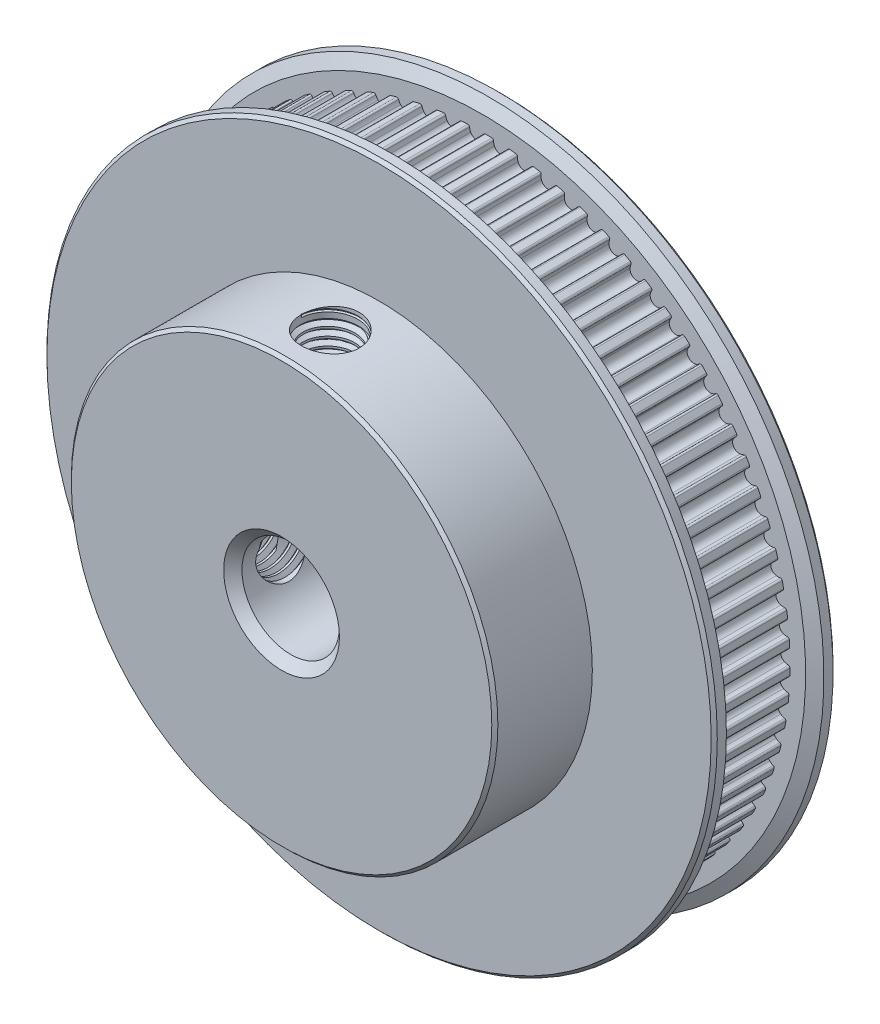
SolidWorks part; units mm, degrees
ref_plane "Front Plane" through (0, 0, 0) normal (0, 0, 1) x (1, 0, 0)
ref_plane "Top Plane" through (0, 0, 0) normal (0, 1, 0) x (1, 0, 0)
ref_plane "Right Plane" through (0, 0, 0) normal (1, 0, 0) x (0, 0, -1)
sketch "Sketch1" plane through (0, 0, 0) normal (0, 0, 1) x (1, 0, 0)
  point P0 (0, 0)
  circle B0 centre (0, 0) radius 4
  arc B1 (19.0272, -16.5574) -> (19.0206, -16.3595) centre (18.9113, -16.4622) ccw
  arc B2 (18.8243, -16.0882) -> (19.0206, -16.3595) centre (19.7211, -15.6459) ccw
  arc B3 (18.902, -15.5099) -> (18.8243, -16.0882) centre (19.331, -15.8619) ccw
  arc B4 (19.454, -15.3207) -> (18.902, -15.5099) centre (19.331, -15.8619) ccw
  arc B5 (19.7585, -15.4603) -> (19.454, -15.3207) centre (19.1953, -16.2867) ccw
  arc B6 (19.7585, -15.4603) -> (19.9538, -15.4282) centre (19.8378, -15.333) ccw
  arc B7 (19.9538, -15.4282) -> (20.2676, -15.0135) centre (0.0094, -0.0071) ccw
  arc B8 (20.2676, -15.0135) -> (20.2455, -14.8168) centre (20.1446, -14.9277) ccw
  arc B9 (20.0285, -14.5617) -> (20.2455, -14.8168) centre (20.8879, -14.0504) ccw
  arc B10 (20.0606, -13.979) -> (20.0285, -14.5617) centre (20.516, -14.2963) ccw
  arc B11 (20.5961, -13.7472) -> (20.0606, -13.979) centre (20.516, -14.2963) ccw
  arc B12 (20.9105, -13.8624) -> (20.5961, -13.7472) centre (20.414, -14.7304) ccw
  arc B13 (20.9105, -13.8624) -> (21.1027, -13.815) centre (20.9797, -13.7293) ccw
  arc B14 (21.1027, -13.815) -> (21.3831, -13.377) centre (0.01, -0.0064) ccw
  arc B15 (21.3831, -13.377) -> (21.3456, -13.1826) centre (21.2537, -13.3012) ccw
  arc B16 (21.1093, -12.9454) -> (21.3456, -13.1826) centre (21.9259, -12.3682) ccw
  arc B17 (21.0956, -12.362) -> (21.1093, -12.9454) centre (21.5744, -12.6426) ccw
  arc B18 (21.6112, -12.0888) -> (21.0956, -12.362) centre (21.5744, -12.6426) ccw
  arc B19 (21.9337, -12.1791) -> (21.6112, -12.0888) centre (21.5068, -13.0834) ccw
  arc B20 (21.9337, -12.1791) -> (22.1216, -12.1168) centre (21.9922, -12.0409) ccw
  arc B21 (22.1216, -12.1168) -> (22.3667, -11.6581) centre (0.0104, -0.0056) ccw
  arc B22 (22.3667, -11.6581) -> (22.3141, -11.4672) centre (22.2318, -11.5926) ccw
  arc B23 (22.0599, -11.2493) -> (22.3141, -11.4672) centre (22.8287, -10.6098) ccw
  arc B24 (22.0004, -10.6687) -> (22.0599, -11.2493) centre (22.4998, -10.9109) ccw
  arc B25 (22.4931, -10.356) -> (22.0004, -10.6687) centre (22.4998, -10.9109) ccw
  arc B26 (22.8217, -10.4206) -> (22.4931, -10.356) centre (22.467, -11.3556) ccw
  arc B27 (22.8217, -10.4206) -> (23.0041, -10.3438) centre (22.8691, -10.2783) ccw
  arc B28 (23.0041, -10.3438) -> (23.2125, -9.8673) centre (0.0108, -0.0047) ccw
  arc B29 (23.2125, -9.8673) -> (23.145, -9.6811) centre (23.0728, -9.8126) ccw
  arc B30 (22.8745, -9.4838) -> (23.145, -9.6811) centre (23.5908, -8.786) ccw
  arc B31 (22.7697, -8.9097) -> (22.8745, -9.4838) centre (23.2865, -9.112) ccw
  arc B32 (23.2363, -8.5592) -> (22.7697, -8.9097) centre (23.2865, -9.112) ccw
  arc B33 (23.5689, -8.5979) -> (23.2363, -8.5592) centre (23.2887, -9.5579) ccw
  arc B34 (23.5689, -8.5979) -> (23.7447, -8.507) centre (23.605, -8.4523) ccw
  arc B35 (23.7447, -8.507) -> (23.9151, -8.0156) centre (0.0112, -0.0039) ccw
  arc B36 (23.9151, -8.0156) -> (23.8333, -7.8354) centre (23.7715, -7.9721) ccw
  arc B37 (23.5481, -7.6599) -> (23.8333, -7.8354) centre (24.2074, -6.908) ccw
  arc B38 (23.3985, -7.0958) -> (23.5481, -7.6599) centre (23.9296, -7.2568) ccw
  arc B39 (23.8362, -6.7098) -> (23.3985, -7.0958) centre (23.9296, -7.2568) ccw
  arc B40 (24.1708, -6.7222) -> (23.8362, -6.7098) centre (23.9668, -7.7012) ccw
  arc B41 (24.1708, -6.7222) -> (24.339, -6.6178) centre (24.1954, -6.5743) ccw
  arc B42 (24.339, -6.6178) -> (24.4703, -6.1145) centre (0.0115, -0.003) ccw
  arc B43 (24.4703, -6.1145) -> (24.3746, -5.9413) centre (24.3237, -6.0824) ccw
  arc B44 (24.0765, -5.7887) -> (24.3746, -5.9413) centre (24.6747, -4.9874) ccw
  arc B45 (23.8831, -5.2381) -> (24.0765, -5.7887) centre (24.4252, -5.357) ccw
  arc B46 (24.2891, -4.8189) -> (23.8831, -5.2381) centre (24.4252, -5.357) ccw
  arc B47 (24.6237, -4.8051) -> (24.2891, -4.8189) centre (24.4972, -5.797) ccw
  arc B48 (24.6237, -4.8051) -> (24.7832, -4.6878) centre (24.6367, -4.6556) ccw
  arc B49 (24.7832, -4.6878) -> (24.8746, -4.1758) centre (0.0117, -0.0021) ccw
  arc B50 (24.8746, -4.1758) -> (24.7656, -4.0106) centre (24.726, -4.1552) ccw
  arc B51 (24.4564, -3.8818) -> (24.7656, -4.0106) centre (24.99, -3.0361) ccw
  arc B52 (24.2205, -3.3481) -> (24.4564, -3.8818) centre (24.7703, -3.4241) ccw
  arc B53 (24.5924, -2.8984) -> (24.2205, -3.3481) centre (24.7703, -3.4241) ccw
  arc B54 (24.9248, -2.8583) -> (24.5924, -2.8984) centre (24.8765, -3.8571) ccw
  arc B55 (24.9248, -2.8583) -> (25.0746, -2.7289) centre (24.926, -2.7083) ccw
  arc B56 (25.0746, -2.7289) -> (25.1255, -2.2113) centre (0.0118, -0.0012) ccw
  arc B57 (25.1255, -2.2113) -> (25.0039, -2.0551) centre (24.9758, -2.2025) ccw
  arc B58 (24.6856, -1.951) -> (25.0039, -2.0551) centre (25.1512, -1.066) ccw
  arc B59 (24.4085, -1.4374) -> (24.6856, -1.951) centre (24.9625, -1.4701) ccw
  arc B60 (24.744, -0.9599) -> (24.4085, -1.4374) centre (24.9625, -1.4701) ccw
  arc B61 (25.0723, -0.8939) -> (24.744, -0.9599) centre (25.1024, -1.8935) ccw
  arc B62 (25.0723, -0.8939) -> (25.2114, -0.7531) centre (25.0616, -0.7443) ccw
  arc B63 (25.2114, -0.7531) -> (25.2215, -0.2331) centre (0.0118, -0.0002) ccw
  arc B64 (25.2215, -0.2331) -> (25.088, -0.087) centre (25.0716, -0.2361) ccw
  arc B65 (24.7626, -0.0082) -> (25.088, -0.087) centre (25.1573, 0.9106) ccw
  arc B66 (24.446, 0.4821) -> (24.7626, -0.0082) centre (25.0009, 0.493) ccw
  arc B67 (24.743, 0.9844) -> (24.446, 0.4821) centre (25.0009, 0.493) ccw
  arc B68 (25.0651, 1.076) -> (24.743, 0.9844) centre (25.1736, 0.0819) ccw
  arc B69 (25.0651, 1.076) -> (25.1928, 1.2273) centre (25.0428, 1.2243) ccw
  arc B70 (25.1928, 1.2273) -> (25.1621, 1.7465) centre (0.0118, 0.0007) ccw
  arc B71 (25.1621, 1.7465) -> (25.0175, 1.8817) centre (25.0128, 1.7317) ccw
  arc B72 (24.6869, 1.9347) -> (25.0175, 1.8817) centre (25.0083, 2.8816) ccw
  arc B73 (24.3329, 2.3986) -> (24.6869, 1.9347) centre (24.8852, 2.453) ccw
  arc B74 (24.5895, 2.9227) -> (24.3329, 2.3986) centre (24.8852, 2.453) ccw
  arc B75 (24.9034, 3.0393) -> (24.5895, 2.9227) centre (25.0896, 2.0567) ccw
  arc B76 (24.9034, 3.0393) -> (25.0188, 3.2001) centre (24.8695, 3.1854) ccw
  arc B77 (25.0188, 3.2001) -> (24.9475, 3.7153) centre (0.0117, 0.0016) ccw
  arc B78 (24.9475, 3.7153) -> (24.7928, 3.8387) centre (24.7998, 3.6889) ccw
  arc B79 (24.459, 3.8656) -> (24.7928, 3.8387) centre (24.7051, 4.8349) ccw
  arc B80 (24.0697, 4.3003) -> (24.459, 3.8656) centre (24.616, 4.3979) ccw
  arc B81 (24.2844, 4.843) -> (24.0697, 4.3003) centre (24.616, 4.3979) ccw
  arc B82 (24.5882, 4.9838) -> (24.2844, 4.843) centre (24.8509, 4.0189) ccw
  arc B83 (24.5882, 4.9838) -> (24.6906, 5.1532) centre (24.5429, 5.1268) ccw
  arc B84 (24.6906, 5.1532) -> (24.5791, 5.6612) centre (0.0116, 0.0025) ccw
  arc B85 (24.5791, 5.6612) -> (24.4152, 5.7721) centre (24.434, 5.6233) ccw
  arc B86 (24.0803, 5.7727) -> (24.4152, 5.7721) centre (24.2496, 6.7583) ccw
  arc B87 (23.6581, 6.1756) -> (24.0803, 5.7727) centre (24.1951, 6.3157) ccw
  arc B88 (23.8295, 6.7334) -> (23.6581, 6.1756) centre (24.1951, 6.3157) ccw
  arc B89 (24.1214, 6.8976) -> (23.8295, 6.7334) centre (24.4589, 5.9563) ccw
  arc B90 (24.1214, 6.8976) -> (24.2102, 7.0745) centre (24.065, 7.0366) ccw
  arc B91 (24.2102, 7.0745) -> (24.0592, 7.5722) centre (0.0113, 0.0034) ccw
  arc B92 (24.0592, 7.5722) -> (23.887, 7.6699) centre (23.9174, 7.523) ccw
  arc B93 (23.5531, 7.6443) -> (23.887, 7.6699) centre (23.6446, 8.6401) ccw
  arc B94 (23.1006, 8.0127) -> (23.5531, 7.6443) centre (23.625, 8.1946) ccw
  arc B95 (23.2278, 8.5822) -> (23.1006, 8.0127) centre (23.625, 8.1946) ccw
  arc B96 (23.5058, 8.7689) -> (23.2278, 8.5822) centre (23.9162, 7.8569) ccw
  arc B97 (23.5058, 8.7689) -> (23.5805, 8.9522) centre (23.4388, 8.903) ccw
  arc B98 (23.5805, 8.9522) -> (23.3909, 9.4365) centre (0.011, 0.0043) ccw
  arc B99 (23.3909, 9.4365) -> (23.2116, 9.5204) centre (23.2535, 9.3764) ccw
  arc B100 (22.8808, 9.4686) -> (23.2116, 9.5204) centre (22.8938, 10.4686) ccw
  arc B101 (22.4007, 9.8005) -> (22.8808, 9.4686) centre (22.9092, 10.0229) ccw
  arc B102 (22.4828, 10.3782) -> (22.4007, 9.8005) centre (22.9092, 10.0229) ccw
  arc B103 (22.7454, 10.5861) -> (22.4828, 10.3782) centre (23.226, 9.7092) ccw
  arc B104 (22.7454, 10.5861) -> (22.8054, 10.7747) centre (22.668, 10.7146) ccw
  arc B105 (22.8054, 10.7747) -> (22.5784, 11.2426) centre (0.0106, 0.0052) ccw
  arc B106 (22.5784, 11.2426) -> (22.3931, 11.3122) centre (22.4461, 11.1719) ccw
  arc B107 (22.0673, 11.2347) -> (22.3931, 11.3122) centre (22.0019, 12.2325) ccw
  arc B108 (21.5627, 11.5278) -> (22.0673, 11.2347) centre (22.0522, 11.7895) ccw
  arc B109 (21.5992, 12.1102) -> (21.5627, 11.5278) centre (22.0522, 11.7895) ccw
  arc B110 (21.8447, 12.338) -> (21.5992, 12.1102) centre (22.3927, 11.5015) ccw
  arc B111 (21.8447, 12.338) -> (21.8897, 12.5308) centre (21.7575, 12.4601) ccw
  arc B112 (21.8897, 12.5308) -> (21.6267, 12.9794) centre (0.0102, 0.006) ccw
  arc B113 (21.6267, 12.9794) -> (21.4365, 13.0343) centre (21.5004, 12.8986) ccw
  arc B114 (21.1178, 12.9314) -> (21.4365, 13.0343) centre (20.9743, 13.9211) ccw
  arc B115 (20.5918, 13.184) -> (21.1178, 12.9314) centre (21.0592, 13.4833) ccw
  arc B116 (20.5825, 13.7675) -> (20.5918, 13.184) centre (21.0592, 13.4833) ccw
  arc B117 (20.8093, 14.0139) -> (20.5825, 13.7675) centre (21.4212, 13.223) ccw
  arc B118 (20.8093, 14.0139) -> (20.8391, 14.2096) centre (20.7128, 14.1287) ccw
  arc B119 (20.8391, 14.2096) -> (20.5417, 14.6362) centre (0.0097, 0.0068) ccw
  arc B120 (20.5417, 14.6362) -> (20.3478, 14.676) centre (20.4221, 14.5457) ccw
  arc B121 (20.0382, 14.5484) -> (20.3478, 14.676) centre (19.8174, 15.5238) ccw
  arc B122 (19.4939, 14.759) -> (20.0382, 14.5484) centre (19.9364, 15.094) ccw
  arc B123 (19.4389, 15.34) -> (19.4939, 14.759) centre (19.9364, 15.094) ccw
  arc B124 (19.6457, 15.6034) -> (19.4389, 15.34) centre (20.3177, 14.8629) ccw
  arc B125 (19.6457, 15.6034) -> (19.66, 15.8008) centre (19.5404, 15.7103) ccw
  arc B126 (19.66, 15.8008) -> (19.33, 16.2028) centre (0.0091, 0.0075) ccw
  arc B127 (19.33, 16.2028) -> (19.1336, 16.2272) centre (19.2179, 16.1032) ccw
  arc B128 (18.8349, 16.0758) -> (19.1336, 16.2272) centre (18.5383, 17.0308) ccw
  arc B129 (18.2758, 16.243) -> (18.8349, 16.0758) centre (18.6907, 16.6117) ccw
  arc B130 (18.1754, 16.8178) -> (18.2758, 16.243) centre (18.6907, 16.6117) ccw
  arc B131 (18.3609, 17.0967) -> (18.1754, 16.8178) centre (19.089, 16.4112) ccw
  arc B132 (18.3609, 17.0967) -> (18.3597, 17.2946) centre (18.2476, 17.195) ccw
  arc B133 (18.3597, 17.2946) -> (17.9992, 17.6695) centre (0.0085, 0.0082) ccw
  arc B134 (17.9992, 17.6695) -> (17.8014, 17.6784) centre (17.8952, 17.5613) ccw
  arc B135 (17.5156, 17.504) -> (17.8014, 17.6784) centre (17.145, 18.4328) ccw
  arc B136 (16.9451, 17.6268) -> (17.5156, 17.504) centre (17.3297, 18.0269) ccw
  arc B137 (16.7998, 18.192) -> (16.9451, 17.6268) centre (17.3297, 18.0269) ccw
  arc B138 (16.9629, 18.4845) -> (16.7998, 18.192) centre (17.7425, 17.8583) ccw
  arc B139 (16.9629, 18.4845) -> (16.9462, 18.6818) centre (16.8422, 18.5736) ccw
  arc B140 (16.9462, 18.6818) -> (16.5574, 19.0272) centre (0.0079, 0.0088) ccw
  arc B141 (16.5574, 19.0272) -> (16.3595, 19.0206) centre (16.4622, 18.9113) ccw
  arc B142 (16.0882, 18.8243) -> (16.3595, 19.0206) centre (15.6459, 19.7211) ccw
  arc B143 (15.5099, 18.902) -> (16.0882, 18.8243) centre (15.8619, 19.331) ccw
  arc B144 (15.3207, 19.454) -> (15.5099, 18.902) centre (15.8619, 19.331) ccw
  arc B145 (15.4603, 19.7585) -> (15.3207, 19.454) centre (16.2867, 19.1953) ccw
  arc B146 (15.4603, 19.7585) -> (15.4282, 19.9538) centre (15.333, 19.8378) ccw
  arc B147 (15.4282, 19.9538) -> (15.0135, 20.2676) centre (0.0071, 0.0094) ccw
  arc B148 (15.0135, 20.2676) -> (14.8168, 20.2455) centre (14.9277, 20.1446) ccw
  arc B149 (14.5617, 20.0285) -> (14.8168, 20.2455) centre (14.0504, 20.8879) ccw
  arc B150 (13.979, 20.0606) -> (14.5617, 20.0285) centre (14.2963, 20.516) ccw
  arc B151 (13.7472, 20.5961) -> (13.979, 20.0606) centre (14.2963, 20.516) ccw
  arc B152 (13.8624, 20.9105) -> (13.7472, 20.5961) centre (14.7304, 20.414) ccw
  arc B153 (13.8624, 20.9105) -> (13.815, 21.1027) centre (13.7293, 20.9797) ccw
  arc B154 (13.815, 21.1027) -> (13.377, 21.3831) centre (0.0064, 0.01) ccw
  arc B155 (13.377, 21.3831) -> (13.1826, 21.3456) centre (13.3012, 21.2537) ccw
  arc B156 (12.9454, 21.1093) -> (13.1826, 21.3456) centre (12.3682, 21.9259) ccw
  arc B157 (12.362, 21.0956) -> (12.9454, 21.1093) centre (12.6426, 21.5744) ccw
  arc B158 (12.0888, 21.6112) -> (12.362, 21.0956) centre (12.6426, 21.5744) ccw
  arc B159 (12.1791, 21.9337) -> (12.0888, 21.6112) centre (13.0834, 21.5068) ccw
  arc B160 (12.1791, 21.9337) -> (12.1168, 22.1216) centre (12.0409, 21.9922) ccw
  arc B161 (12.1168, 22.1216) -> (11.6581, 22.3667) centre (0.0056, 0.0104) ccw
  arc B162 (11.6581, 22.3667) -> (11.4672, 22.3141) centre (11.5926, 22.2318) ccw
  arc B163 (11.2493, 22.0599) -> (11.4672, 22.3141) centre (10.6098, 22.8287) ccw
  arc B164 (10.6687, 22.0004) -> (11.2493, 22.0599) centre (10.9109, 22.4998) ccw
  arc B165 (10.356, 22.4931) -> (10.6687, 22.0004) centre (10.9109, 22.4998) ccw
  arc B166 (10.4206, 22.8217) -> (10.356, 22.4931) centre (11.3556, 22.467) ccw
  arc B167 (10.4206, 22.8217) -> (10.3438, 23.0041) centre (10.2783, 22.8691) ccw
  arc B168 (10.3438, 23.0041) -> (9.8673, 23.2125) centre (0.0047, 0.0108) ccw
  arc B169 (9.8673, 23.2125) -> (9.6811, 23.145) centre (9.8126, 23.0728) ccw
  arc B170 (9.4838, 22.8745) -> (9.6811, 23.145) centre (8.786, 23.5908) ccw
  arc B171 (8.9097, 22.7697) -> (9.4838, 22.8745) centre (9.112, 23.2865) ccw
  arc B172 (8.5592, 23.2363) -> (8.9097, 22.7697) centre (9.112, 23.2865) ccw
  arc B173 (8.5979, 23.5689) -> (8.5592, 23.2363) centre (9.5579, 23.2887) ccw
  arc B174 (8.5979, 23.5689) -> (8.507, 23.7447) centre (8.4523, 23.605) ccw
  arc B175 (8.507, 23.7447) -> (8.0156, 23.9151) centre (0.0039, 0.0112) ccw
  arc B176 (8.0156, 23.9151) -> (7.8354, 23.8333) centre (7.9721, 23.7715) ccw
  arc B177 (7.6599, 23.5481) -> (7.8354, 23.8333) centre (6.908, 24.2074) ccw
  arc B178 (7.0958, 23.3985) -> (7.6599, 23.5481) centre (7.2568, 23.9296) ccw
  arc B179 (6.7098, 23.8362) -> (7.0958, 23.3985) centre (7.2568, 23.9296) ccw
  arc B180 (6.7222, 24.1708) -> (6.7098, 23.8362) centre (7.7012, 23.9668) ccw
  arc B181 (6.7222, 24.1708) -> (6.6178, 24.339) centre (6.5743, 24.1954) ccw
  arc B182 (6.6178, 24.339) -> (6.1145, 24.4703) centre (0.003, 0.0115) ccw
  arc B183 (6.1145, 24.4703) -> (5.9413, 24.3746) centre (6.0824, 24.3237) ccw
  arc B184 (5.7887, 24.0765) -> (5.9413, 24.3746) centre (4.9874, 24.6747) ccw
  arc B185 (5.2381, 23.8831) -> (5.7887, 24.0765) centre (5.357, 24.4252) ccw
  arc B186 (4.8189, 24.2891) -> (5.2381, 23.8831) centre (5.357, 24.4252) ccw
  arc B187 (4.8051, 24.6237) -> (4.8189, 24.2891) centre (5.797, 24.4972) ccw
  arc B188 (4.8051, 24.6237) -> (4.6878, 24.7832) centre (4.6556, 24.6367) ccw
  arc B189 (4.6878, 24.7832) -> (4.1758, 24.8746) centre (0.0021, 0.0117) ccw
  arc B190 (4.1758, 24.8746) -> (4.0106, 24.7656) centre (4.1552, 24.726) ccw
  arc B191 (3.8818, 24.4564) -> (4.0106, 24.7656) centre (3.0361, 24.99) ccw
  arc B192 (3.3481, 24.2205) -> (3.8818, 24.4564) centre (3.4241, 24.7703) ccw
  arc B193 (2.8984, 24.5924) -> (3.3481, 24.2205) centre (3.4241, 24.7703) ccw
  arc B194 (2.8583, 24.9248) -> (2.8984, 24.5924) centre (3.8571, 24.8765) ccw
  arc B195 (2.8583, 24.9248) -> (2.7289, 25.0746) centre (2.7083, 24.926) ccw
  arc B196 (2.7289, 25.0746) -> (2.2113, 25.1255) centre (0.0012, 0.0118) ccw
  arc B197 (2.2113, 25.1255) -> (2.0551, 25.0039) centre (2.2025, 24.9758) ccw
  arc B198 (1.951, 24.6856) -> (2.0551, 25.0039) centre (1.066, 25.1512) ccw
  arc B199 (1.4374, 24.4085) -> (1.951, 24.6856) centre (1.4701, 24.9625) ccw
  arc B200 (0.9599, 24.744) -> (1.4374, 24.4085) centre (1.4701, 24.9625) ccw
  arc B201 (0.8939, 25.0723) -> (0.9599, 24.744) centre (1.8935, 25.1024) ccw
  arc B202 (0.8939, 25.0723) -> (0.7531, 25.2114) centre (0.7443, 25.0616) ccw
  arc B203 (0.7531, 25.2114) -> (0.2331, 25.2215) centre (0.0002, 0.0118) ccw
  arc B204 (0.2331, 25.2215) -> (0.087, 25.088) centre (0.2361, 25.0716) ccw
  arc B205 (0.0082, 24.7626) -> (0.087, 25.088) centre (-0.9106, 25.1573) ccw
  arc B206 (-0.4821, 24.446) -> (0.0082, 24.7626) centre (-0.493, 25.0009) ccw
  arc B207 (-0.9844, 24.743) -> (-0.4821, 24.446) centre (-0.493, 25.0009) ccw
  arc B208 (-1.076, 25.0651) -> (-0.9844, 24.743) centre (-0.0819, 25.1736) ccw
  arc B209 (-1.076, 25.0651) -> (-1.2273, 25.1928) centre (-1.2243, 25.0428) ccw
  arc B210 (-1.2273, 25.1928) -> (-1.7465, 25.1621) centre (-0.0007, 0.0118) ccw
  arc B211 (-1.7465, 25.1621) -> (-1.8817, 25.0175) centre (-1.7317, 25.0128) ccw
  arc B212 (-1.9347, 24.6869) -> (-1.8817, 25.0175) centre (-2.8816, 25.0083) ccw
  arc B213 (-2.3986, 24.3329) -> (-1.9347, 24.6869) centre (-2.453, 24.8852) ccw
  arc B214 (-2.9227, 24.5895) -> (-2.3986, 24.3329) centre (-2.453, 24.8852) ccw
  arc B215 (-3.0393, 24.9034) -> (-2.9227, 24.5895) centre (-2.0567, 25.0896) ccw
  arc B216 (-3.0393, 24.9034) -> (-3.2001, 25.0188) centre (-3.1854, 24.8695) ccw
  arc B217 (-3.2001, 25.0188) -> (-3.7153, 24.9475) centre (-0.0016, 0.0117) ccw
  arc B218 (-3.7153, 24.9475) -> (-3.8387, 24.7928) centre (-3.6889, 24.7998) ccw
  arc B219 (-3.8656, 24.459) -> (-3.8387, 24.7928) centre (-4.8349, 24.7051) ccw
  arc B220 (-4.3003, 24.0697) -> (-3.8656, 24.459) centre (-4.3979, 24.616) ccw
  arc B221 (-4.843, 24.2844) -> (-4.3003, 24.0697) centre (-4.3979, 24.616) ccw
  arc B222 (-4.9838, 24.5882) -> (-4.843, 24.2844) centre (-4.0189, 24.8509) ccw
  arc B223 (-4.9838, 24.5882) -> (-5.1532, 24.6906) centre (-5.1268, 24.5429) ccw
  arc B224 (-5.1532, 24.6906) -> (-5.6612, 24.5791) centre (-0.0025, 0.0116) ccw
  arc B225 (-5.6612, 24.5791) -> (-5.7721, 24.4152) centre (-5.6233, 24.434) ccw
  arc B226 (-5.7727, 24.0803) -> (-5.7721, 24.4152) centre (-6.7583, 24.2496) ccw
  arc B227 (-6.1756, 23.6581) -> (-5.7727, 24.0803) centre (-6.3157, 24.1951) ccw
  arc B228 (-6.7334, 23.8295) -> (-6.1756, 23.6581) centre (-6.3157, 24.1951) ccw
  arc B229 (-6.8976, 24.1214) -> (-6.7334, 23.8295) centre (-5.9563, 24.4589) ccw
  arc B230 (-6.8976, 24.1214) -> (-7.0745, 24.2102) centre (-7.0366, 24.065) ccw
  arc B231 (-7.0745, 24.2102) -> (-7.5722, 24.0592) centre (-0.0034, 0.0113) ccw
  arc B232 (-7.5722, 24.0592) -> (-7.6699, 23.887) centre (-7.523, 23.9174) ccw
  arc B233 (-7.6443, 23.5531) -> (-7.6699, 23.887) centre (-8.6401, 23.6446) ccw
  arc B234 (-8.0127, 23.1006) -> (-7.6443, 23.5531) centre (-8.1946, 23.625) ccw
  arc B235 (-8.5822, 23.2278) -> (-8.0127, 23.1006) centre (-8.1946, 23.625) ccw
  arc B236 (-8.7689, 23.5058) -> (-8.5822, 23.2278) centre (-7.8569, 23.9162) ccw
  arc B237 (-8.7689, 23.5058) -> (-8.9522, 23.5805) centre (-8.903, 23.4388) ccw
  arc B238 (-8.9522, 23.5805) -> (-9.4365, 23.3909) centre (-0.0043, 0.011) ccw
  arc B239 (-9.4365, 23.3909) -> (-9.5204, 23.2116) centre (-9.3764, 23.2535) ccw
  arc B240 (-9.4686, 22.8808) -> (-9.5204, 23.2116) centre (-10.4686, 22.8938) ccw
  arc B241 (-9.8005, 22.4007) -> (-9.4686, 22.8808) centre (-10.0229, 22.9092) ccw
  arc B242 (-10.3782, 22.4828) -> (-9.8005, 22.4007) centre (-10.0229, 22.9092) ccw
  arc B243 (-10.5861, 22.7454) -> (-10.3782, 22.4828) centre (-9.7092, 23.226) ccw
  arc B244 (-10.5861, 22.7454) -> (-10.7747, 22.8054) centre (-10.7146, 22.668) ccw
  arc B245 (-10.7747, 22.8054) -> (-11.2426, 22.5784) centre (-0.0052, 0.0106) ccw
  arc B246 (-11.2426, 22.5784) -> (-11.3122, 22.3931) centre (-11.1719, 22.4461) ccw
  arc B247 (-11.2347, 22.0673) -> (-11.3122, 22.3931) centre (-12.2325, 22.0019) ccw
  arc B248 (-11.5278, 21.5627) -> (-11.2347, 22.0673) centre (-11.7895, 22.0522) ccw
  arc B249 (-12.1102, 21.5992) -> (-11.5278, 21.5627) centre (-11.7895, 22.0522) ccw
  arc B250 (-12.338, 21.8447) -> (-12.1102, 21.5992) centre (-11.5015, 22.3927) ccw
  arc B251 (-12.338, 21.8447) -> (-12.5308, 21.8897) centre (-12.4601, 21.7575) ccw
  arc B252 (-12.5308, 21.8897) -> (-12.9794, 21.6267) centre (-0.006, 0.0102) ccw
  arc B253 (-12.9794, 21.6267) -> (-13.0343, 21.4365) centre (-12.8986, 21.5004) ccw
  arc B254 (-12.9314, 21.1178) -> (-13.0343, 21.4365) centre (-13.9211, 20.9743) ccw
  arc B255 (-13.184, 20.5918) -> (-12.9314, 21.1178) centre (-13.4833, 21.0592) ccw
  arc B256 (-13.7675, 20.5825) -> (-13.184, 20.5918) centre (-13.4833, 21.0592) ccw
  arc B257 (-14.0139, 20.8093) -> (-13.7675, 20.5825) centre (-13.223, 21.4212) ccw
  arc B258 (-14.0139, 20.8093) -> (-14.2096, 20.8391) centre (-14.1287, 20.7128) ccw
  arc B259 (-14.2096, 20.8391) -> (-14.6362, 20.5417) centre (-0.0068, 0.0097) ccw
  arc B260 (-14.6362, 20.5417) -> (-14.676, 20.3478) centre (-14.5457, 20.4221) ccw
  arc B261 (-14.5484, 20.0382) -> (-14.676, 20.3478) centre (-15.5238, 19.8174) ccw
  arc B262 (-14.759, 19.4939) -> (-14.5484, 20.0382) centre (-15.094, 19.9364) ccw
  arc B263 (-15.34, 19.4389) -> (-14.759, 19.4939) centre (-15.094, 19.9364) ccw
  arc B264 (-15.6034, 19.6457) -> (-15.34, 19.4389) centre (-14.8629, 20.3177) ccw
  arc B265 (-15.6034, 19.6457) -> (-15.8008, 19.66) centre (-15.7103, 19.5404) ccw
  arc B266 (-15.8008, 19.66) -> (-16.2028, 19.33) centre (-0.0075, 0.0091) ccw
  arc B267 (-16.2028, 19.33) -> (-16.2272, 19.1336) centre (-16.1032, 19.2179) ccw
  arc B268 (-16.0758, 18.8349) -> (-16.2272, 19.1336) centre (-17.0308, 18.5383) ccw
  arc B269 (-16.243, 18.2758) -> (-16.0758, 18.8349) centre (-16.6117, 18.6907) ccw
  arc B270 (-16.8178, 18.1754) -> (-16.243, 18.2758) centre (-16.6117, 18.6907) ccw
  arc B271 (-17.0967, 18.3609) -> (-16.8178, 18.1754) centre (-16.4112, 19.089) ccw
  arc B272 (-17.0967, 18.3609) -> (-17.2946, 18.3597) centre (-17.195, 18.2476) ccw
  arc B273 (-17.2946, 18.3597) -> (-17.6695, 17.9992) centre (-0.0082, 0.0085) ccw
  arc B274 (-17.6695, 17.9992) -> (-17.6784, 17.8014) centre (-17.5613, 17.8952) ccw
  arc B275 (-17.504, 17.5156) -> (-17.6784, 17.8014) centre (-18.4328, 17.145) ccw
  arc B276 (-17.6268, 16.9451) -> (-17.504, 17.5156) centre (-18.0269, 17.3297) ccw
  arc B277 (-18.192, 16.7998) -> (-17.6268, 16.9451) centre (-18.0269, 17.3297) ccw
  arc B278 (-18.4845, 16.9629) -> (-18.192, 16.7998) centre (-17.8583, 17.7425) ccw
  arc B279 (-18.4845, 16.9629) -> (-18.6818, 16.9462) centre (-18.5736, 16.8422) ccw
  arc B280 (-18.6818, 16.9462) -> (-19.0272, 16.5574) centre (-0.0088, 0.0079) ccw
  arc B281 (-19.0272, 16.5574) -> (-19.0206, 16.3595) centre (-18.9113, 16.4622) ccw
  arc B282 (-18.8243, 16.0882) -> (-19.0206, 16.3595) centre (-19.7211, 15.6459) ccw
  arc B283 (-18.902, 15.5099) -> (-18.8243, 16.0882) centre (-19.331, 15.8619) ccw
  arc B284 (-19.454, 15.3207) -> (-18.902, 15.5099) centre (-19.331, 15.8619) ccw
  arc B285 (-19.7585, 15.4603) -> (-19.454, 15.3207) centre (-19.1953, 16.2867) ccw
  arc B286 (-19.7585, 15.4603) -> (-19.9538, 15.4282) centre (-19.8378, 15.333) ccw
  arc B287 (-19.9538, 15.4282) -> (-20.2676, 15.0135) centre (-0.0094, 0.0071) ccw
  arc B288 (-20.2676, 15.0135) -> (-20.2455, 14.8168) centre (-20.1446, 14.9277) ccw
  arc B289 (-20.0285, 14.5617) -> (-20.2455, 14.8168) centre (-20.8879, 14.0504) ccw
  arc B290 (-20.0606, 13.979) -> (-20.0285, 14.5617) centre (-20.516, 14.2963) ccw
  arc B291 (-20.5961, 13.7472) -> (-20.0606, 13.979) centre (-20.516, 14.2963) ccw
  arc B292 (-20.9105, 13.8624) -> (-20.5961, 13.7472) centre (-20.414, 14.7304) ccw
  arc B293 (-20.9105, 13.8624) -> (-21.1027, 13.815) centre (-20.9797, 13.7293) ccw
  arc B294 (-21.1027, 13.815) -> (-21.3831, 13.377) centre (-0.01, 0.0064) ccw
  arc B295 (-21.3831, 13.377) -> (-21.3456, 13.1826) centre (-21.2537, 13.3012) ccw
  arc B296 (-21.1093, 12.9454) -> (-21.3456, 13.1826) centre (-21.9259, 12.3682) ccw
  arc B297 (-21.0956, 12.362) -> (-21.1093, 12.9454) centre (-21.5744, 12.6426) ccw
  arc B298 (-21.6112, 12.0888) -> (-21.0956, 12.362) centre (-21.5744, 12.6426) ccw
  arc B299 (-21.9337, 12.1791) -> (-21.6112, 12.0888) centre (-21.5068, 13.0834) ccw
  arc B300 (-21.9337, 12.1791) -> (-22.1216, 12.1168) centre (-21.9922, 12.0409) ccw
  arc B301 (-22.1216, 12.1168) -> (-22.3667, 11.6581) centre (-0.0104, 0.0056) ccw
  arc B302 (-22.3667, 11.6581) -> (-22.3141, 11.4672) centre (-22.2318, 11.5926) ccw
  arc B303 (-22.0599, 11.2493) -> (-22.3141, 11.4672) centre (-22.8287, 10.6098) ccw
  arc B304 (-22.0004, 10.6687) -> (-22.0599, 11.2493) centre (-22.4998, 10.9109) ccw
  arc B305 (-22.4931, 10.356) -> (-22.0004, 10.6687) centre (-22.4998, 10.9109) ccw
  arc B306 (-22.8217, 10.4206) -> (-22.4931, 10.356) centre (-22.467, 11.3556) ccw
  arc B307 (-22.8217, 10.4206) -> (-23.0041, 10.3438) centre (-22.8691, 10.2783) ccw
  arc B308 (-23.0041, 10.3438) -> (-23.2125, 9.8673) centre (-0.0108, 0.0047) ccw
  arc B309 (-23.2125, 9.8673) -> (-23.145, 9.6811) centre (-23.0728, 9.8126) ccw
  arc B310 (-22.8745, 9.4838) -> (-23.145, 9.6811) centre (-23.5908, 8.786) ccw
  arc B311 (-22.7697, 8.9097) -> (-22.8745, 9.4838) centre (-23.2865, 9.112) ccw
  arc B312 (-23.2363, 8.5592) -> (-22.7697, 8.9097) centre (-23.2865, 9.112) ccw
  arc B313 (-23.5689, 8.5979) -> (-23.2363, 8.5592) centre (-23.2887, 9.5579) ccw
  arc B314 (-23.5689, 8.5979) -> (-23.7447, 8.507) centre (-23.605, 8.4523) ccw
  arc B315 (-23.7447, 8.507) -> (-23.9151, 8.0156) centre (-0.0112, 0.0039) ccw
  arc B316 (-23.9151, 8.0156) -> (-23.8333, 7.8354) centre (-23.7715, 7.9721) ccw
  arc B317 (-23.5481, 7.6599) -> (-23.8333, 7.8354) centre (-24.2074, 6.908) ccw
  arc B318 (-23.3985, 7.0958) -> (-23.5481, 7.6599) centre (-23.9296, 7.2568) ccw
  arc B319 (-23.8362, 6.7098) -> (-23.3985, 7.0958) centre (-23.9296, 7.2568) ccw
  arc B320 (-24.1708, 6.7222) -> (-23.8362, 6.7098) centre (-23.9668, 7.7012) ccw
  arc B321 (-24.1708, 6.7222) -> (-24.339, 6.6178) centre (-24.1954, 6.5743) ccw
  arc B322 (-24.339, 6.6178) -> (-24.4703, 6.1145) centre (-0.0115, 0.003) ccw
  arc B323 (-24.4703, 6.1145) -> (-24.3746, 5.9413) centre (-24.3237, 6.0824) ccw
  arc B324 (-24.0765, 5.7887) -> (-24.3746, 5.9413) centre (-24.6747, 4.9874) ccw
  arc B325 (-23.8831, 5.2381) -> (-24.0765, 5.7887) centre (-24.4252, 5.357) ccw
  arc B326 (-24.2891, 4.8189) -> (-23.8831, 5.2381) centre (-24.4252, 5.357) ccw
  arc B327 (-24.6237, 4.8051) -> (-24.2891, 4.8189) centre (-24.4972, 5.797) ccw
  arc B328 (-24.6237, 4.8051) -> (-24.7832, 4.6878) centre (-24.6367, 4.6556) ccw
  arc B329 (-24.7832, 4.6878) -> (-24.8746, 4.1758) centre (-0.0117, 0.0021) ccw
  arc B330 (-24.8746, 4.1758) -> (-24.7656, 4.0106) centre (-24.726, 4.1552) ccw
  arc B331 (-24.4564, 3.8818) -> (-24.7656, 4.0106) centre (-24.99, 3.0361) ccw
  arc B332 (-24.2205, 3.3481) -> (-24.4564, 3.8818) centre (-24.7703, 3.4241) ccw
  arc B333 (-24.5924, 2.8984) -> (-24.2205, 3.3481) centre (-24.7703, 3.4241) ccw
  arc B334 (-24.9248, 2.8583) -> (-24.5924, 2.8984) centre (-24.8765, 3.8571) ccw
  arc B335 (-24.9248, 2.8583) -> (-25.0746, 2.7289) centre (-24.926, 2.7083) ccw
  arc B336 (-25.0746, 2.7289) -> (-25.1255, 2.2113) centre (-0.0118, 0.0012) ccw
  arc B337 (-25.1255, 2.2113) -> (-25.0039, 2.0551) centre (-24.9758, 2.2025) ccw
  arc B338 (-24.6856, 1.951) -> (-25.0039, 2.0551) centre (-25.1512, 1.066) ccw
  arc B339 (-24.4085, 1.4374) -> (-24.6856, 1.951) centre (-24.9625, 1.4701) ccw
  arc B340 (-24.744, 0.9599) -> (-24.4085, 1.4374) centre (-24.9625, 1.4701) ccw
  arc B341 (-25.0723, 0.8939) -> (-24.744, 0.9599) centre (-25.1024, 1.8935) ccw
  arc B342 (-25.0723, 0.8939) -> (-25.2114, 0.7531) centre (-25.0616, 0.7443) ccw
  arc B343 (-25.2114, 0.7531) -> (-25.2215, 0.2331) centre (-0.0118, 0.0002) ccw
  arc B344 (-25.2215, 0.2331) -> (-25.088, 0.087) centre (-25.0716, 0.2361) ccw
  arc B345 (-24.7626, 0.0082) -> (-25.088, 0.087) centre (-25.1573, -0.9106) ccw
  arc B346 (-24.446, -0.4821) -> (-24.7626, 0.0082) centre (-25.0009, -0.493) ccw
  arc B347 (-24.743, -0.9844) -> (-24.446, -0.4821) centre (-25.0009, -0.493) ccw
  arc B348 (-25.0651, -1.076) -> (-24.743, -0.9844) centre (-25.1736, -0.0819) ccw
  arc B349 (-25.0651, -1.076) -> (-25.1928, -1.2273) centre (-25.0428, -1.2243) ccw
  arc B350 (-25.1928, -1.2273) -> (-25.1621, -1.7465) centre (-0.0118, -0.0007) ccw
  arc B351 (-25.1621, -1.7465) -> (-25.0175, -1.8817) centre (-25.0128, -1.7317) ccw
  arc B352 (-24.6869, -1.9347) -> (-25.0175, -1.8817) centre (-25.0083, -2.8816) ccw
  arc B353 (-24.3329, -2.3986) -> (-24.6869, -1.9347) centre (-24.8852, -2.453) ccw
  arc B354 (-24.5895, -2.9227) -> (-24.3329, -2.3986) centre (-24.8852, -2.453) ccw
  arc B355 (-24.9034, -3.0393) -> (-24.5895, -2.9227) centre (-25.0896, -2.0567) ccw
  arc B356 (-24.9034, -3.0393) -> (-25.0188, -3.2001) centre (-24.8695, -3.1854) ccw
  arc B357 (-25.0188, -3.2001) -> (-24.9475, -3.7153) centre (-0.0117, -0.0016) ccw
  arc B358 (-24.9475, -3.7153) -> (-24.7928, -3.8387) centre (-24.7998, -3.6889) ccw
  arc B359 (-24.459, -3.8656) -> (-24.7928, -3.8387) centre (-24.7051, -4.8349) ccw
  arc B360 (-24.0697, -4.3003) -> (-24.459, -3.8656) centre (-24.616, -4.3979) ccw
  arc B361 (-24.2844, -4.843) -> (-24.0697, -4.3003) centre (-24.616, -4.3979) ccw
  arc B362 (-24.5882, -4.9838) -> (-24.2844, -4.843) centre (-24.8509, -4.0189) ccw
  arc B363 (-24.5882, -4.9838) -> (-24.6906, -5.1532) centre (-24.5429, -5.1268) ccw
  arc B364 (-24.6906, -5.1532) -> (-24.5791, -5.6612) centre (-0.0116, -0.0025) ccw
  arc B365 (-24.5791, -5.6612) -> (-24.4152, -5.7721) centre (-24.434, -5.6233) ccw
  arc B366 (-24.0803, -5.7727) -> (-24.4152, -5.7721) centre (-24.2496, -6.7583) ccw
  arc B367 (-23.6581, -6.1756) -> (-24.0803, -5.7727) centre (-24.1951, -6.3157) ccw
  arc B368 (-23.8295, -6.7334) -> (-23.6581, -6.1756) centre (-24.1951, -6.3157) ccw
  arc B369 (-24.1214, -6.8976) -> (-23.8295, -6.7334) centre (-24.4589, -5.9563) ccw
  arc B370 (-24.1214, -6.8976) -> (-24.2102, -7.0745) centre (-24.065, -7.0366) ccw
  arc B371 (-24.2102, -7.0745) -> (-24.0592, -7.5722) centre (-0.0113, -0.0034) ccw
  arc B372 (-24.0592, -7.5722) -> (-23.887, -7.6699) centre (-23.9174, -7.523) ccw
  arc B373 (-23.5531, -7.6443) -> (-23.887, -7.6699) centre (-23.6446, -8.6401) ccw
  arc B374 (-23.1006, -8.0127) -> (-23.5531, -7.6443) centre (-23.625, -8.1946) ccw
  arc B375 (-23.2278, -8.5822) -> (-23.1006, -8.0127) centre (-23.625, -8.1946) ccw
  arc B376 (-23.5058, -8.7689) -> (-23.2278, -8.5822) centre (-23.9162, -7.8569) ccw
  arc B377 (-23.5058, -8.7689) -> (-23.5805, -8.9522) centre (-23.4388, -8.903) ccw
  arc B378 (-23.5805, -8.9522) -> (-23.3909, -9.4365) centre (-0.011, -0.0043) ccw
  arc B379 (-23.3909, -9.4365) -> (-23.2116, -9.5204) centre (-23.2535, -9.3764) ccw
  arc B380 (-22.8808, -9.4686) -> (-23.2116, -9.5204) centre (-22.8938, -10.4686) ccw
  arc B381 (-22.4007, -9.8005) -> (-22.8808, -9.4686) centre (-22.9092, -10.0229) ccw
  arc B382 (-22.4828, -10.3782) -> (-22.4007, -9.8005) centre (-22.9092, -10.0229) ccw
  arc B383 (-22.7454, -10.5861) -> (-22.4828, -10.3782) centre (-23.226, -9.7092) ccw
  arc B384 (-22.7454, -10.5861) -> (-22.8054, -10.7747) centre (-22.668, -10.7146) ccw
  arc B385 (-22.8054, -10.7747) -> (-22.5784, -11.2426) centre (-0.0106, -0.0052) ccw
  arc B386 (-22.5784, -11.2426) -> (-22.3931, -11.3122) centre (-22.4461, -11.1719) ccw
  arc B387 (-22.0673, -11.2347) -> (-22.3931, -11.3122) centre (-22.0019, -12.2325) ccw
  arc B388 (-21.5627, -11.5278) -> (-22.0673, -11.2347) centre (-22.0522, -11.7895) ccw
  arc B389 (-21.5992, -12.1102) -> (-21.5627, -11.5278) centre (-22.0522, -11.7895) ccw
  arc B390 (-21.8447, -12.338) -> (-21.5992, -12.1102) centre (-22.3927, -11.5015) ccw
  arc B391 (-21.8447, -12.338) -> (-21.8897, -12.5308) centre (-21.7575, -12.4601) ccw
  arc B392 (-21.8897, -12.5308) -> (-21.6267, -12.9794) centre (-0.0102, -0.006) ccw
  arc B393 (-21.6267, -12.9794) -> (-21.4365, -13.0343) centre (-21.5004, -12.8986) ccw
  arc B394 (-21.1178, -12.9314) -> (-21.4365, -13.0343) centre (-20.9743, -13.9211) ccw
  arc B395 (-20.5918, -13.184) -> (-21.1178, -12.9314) centre (-21.0592, -13.4833) ccw
  arc B396 (-20.5825, -13.7675) -> (-20.5918, -13.184) centre (-21.0592, -13.4833) ccw
  arc B397 (-20.8093, -14.0139) -> (-20.5825, -13.7675) centre (-21.4212, -13.223) ccw
  arc B398 (-20.8093, -14.0139) -> (-20.8391, -14.2096) centre (-20.7128, -14.1287) ccw
  arc B399 (-20.8391, -14.2096) -> (-20.5417, -14.6362) centre (-0.0097, -0.0068) ccw
  arc B400 (-20.5417, -14.6362) -> (-20.3478, -14.676) centre (-20.4221, -14.5457) ccw
  arc B401 (-20.0382, -14.5484) -> (-20.3478, -14.676) centre (-19.8174, -15.5238) ccw
  arc B402 (-19.4939, -14.759) -> (-20.0382, -14.5484) centre (-19.9364, -15.094) ccw
  arc B403 (-19.4389, -15.34) -> (-19.4939, -14.759) centre (-19.9364, -15.094) ccw
  arc B404 (-19.6457, -15.6034) -> (-19.4389, -15.34) centre (-20.3177, -14.8629) ccw
  arc B405 (-19.6457, -15.6034) -> (-19.66, -15.8008) centre (-19.5404, -15.7103) ccw
  arc B406 (-19.66, -15.8008) -> (-19.33, -16.2028) centre (-0.0091, -0.0075) ccw
  arc B407 (-19.33, -16.2028) -> (-19.1336, -16.2272) centre (-19.2179, -16.1032) ccw
  arc B408 (-18.8349, -16.0758) -> (-19.1336, -16.2272) centre (-18.5383, -17.0308) ccw
  arc B409 (-18.2758, -16.243) -> (-18.8349, -16.0758) centre (-18.6907, -16.6117) ccw
  arc B410 (-18.1754, -16.8178) -> (-18.2758, -16.243) centre (-18.6907, -16.6117) ccw
  arc B411 (-18.3609, -17.0967) -> (-18.1754, -16.8178) centre (-19.089, -16.4112) ccw
  arc B412 (-18.3609, -17.0967) -> (-18.3597, -17.2946) centre (-18.2476, -17.195) ccw
  arc B413 (-18.3597, -17.2946) -> (-17.9992, -17.6695) centre (-0.0085, -0.0082) ccw
  arc B414 (-17.9992, -17.6695) -> (-17.8014, -17.6784) centre (-17.8952, -17.5613) ccw
  arc B415 (-17.5156, -17.504) -> (-17.8014, -17.6784) centre (-17.145, -18.4328) ccw
  arc B416 (-16.9451, -17.6268) -> (-17.5156, -17.504) centre (-17.3297, -18.0269) ccw
  arc B417 (-16.7998, -18.192) -> (-16.9451, -17.6268) centre (-17.3297, -18.0269) ccw
  arc B418 (-16.9629, -18.4845) -> (-16.7998, -18.192) centre (-17.7425, -17.8583) ccw
  arc B419 (-16.9629, -18.4845) -> (-16.9462, -18.6818) centre (-16.8422, -18.5736) ccw
  arc B420 (-16.9462, -18.6818) -> (-16.5574, -19.0272) centre (-0.0079, -0.0088) ccw
  arc B421 (-16.5574, -19.0272) -> (-16.3595, -19.0206) centre (-16.4622, -18.9113) ccw
  arc B422 (-16.0882, -18.8243) -> (-16.3595, -19.0206) centre (-15.6459, -19.7211) ccw
  arc B423 (-15.5099, -18.902) -> (-16.0882, -18.8243) centre (-15.8619, -19.331) ccw
  arc B424 (-15.3207, -19.454) -> (-15.5099, -18.902) centre (-15.8619, -19.331) ccw
  arc B425 (-15.4603, -19.7585) -> (-15.3207, -19.454) centre (-16.2867, -19.1953) ccw
  arc B426 (-15.4603, -19.7585) -> (-15.4282, -19.9538) centre (-15.333, -19.8378) ccw
  arc B427 (-15.4282, -19.9538) -> (-15.0135, -20.2676) centre (-0.0071, -0.0094) ccw
  arc B428 (-15.0135, -20.2676) -> (-14.8168, -20.2455) centre (-14.9277, -20.1446) ccw
  arc B429 (-14.5617, -20.0285) -> (-14.8168, -20.2455) centre (-14.0504, -20.8879) ccw
  arc B430 (-13.979, -20.0606) -> (-14.5617, -20.0285) centre (-14.2963, -20.516) ccw
  arc B431 (-13.7472, -20.5961) -> (-13.979, -20.0606) centre (-14.2963, -20.516) ccw
  arc B432 (-13.8624, -20.9105) -> (-13.7472, -20.5961) centre (-14.7304, -20.414) ccw
  arc B433 (-13.8624, -20.9105) -> (-13.815, -21.1027) centre (-13.7293, -20.9797) ccw
  arc B434 (-13.815, -21.1027) -> (-13.377, -21.3831) centre (-0.0064, -0.01) ccw
  arc B435 (-13.377, -21.3831) -> (-13.1826, -21.3456) centre (-13.3012, -21.2537) ccw
  arc B436 (-12.9454, -21.1093) -> (-13.1826, -21.3456) centre (-12.3682, -21.9259) ccw
  arc B437 (-12.362, -21.0956) -> (-12.9454, -21.1093) centre (-12.6426, -21.5744) ccw
  arc B438 (-12.0888, -21.6112) -> (-12.362, -21.0956) centre (-12.6426, -21.5744) ccw
  arc B439 (-12.1791, -21.9337) -> (-12.0888, -21.6112) centre (-13.0834, -21.5068) ccw
  arc B440 (-12.1791, -21.9337) -> (-12.1168, -22.1216) centre (-12.0409, -21.9922) ccw
  arc B441 (-12.1168, -22.1216) -> (-11.6581, -22.3667) centre (-0.0056, -0.0104) ccw
  arc B442 (-11.6581, -22.3667) -> (-11.4672, -22.3141) centre (-11.5926, -22.2318) ccw
  arc B443 (-11.2493, -22.0599) -> (-11.4672, -22.3141) centre (-10.6098, -22.8287) ccw
  arc B444 (-10.6687, -22.0004) -> (-11.2493, -22.0599) centre (-10.9109, -22.4998) ccw
  arc B445 (-10.356, -22.4931) -> (-10.6687, -22.0004) centre (-10.9109, -22.4998) ccw
  arc B446 (-10.4206, -22.8217) -> (-10.356, -22.4931) centre (-11.3556, -22.467) ccw
  arc B447 (-10.4206, -22.8217) -> (-10.3438, -23.0041) centre (-10.2783, -22.8691) ccw
  arc B448 (-10.3438, -23.0041) -> (-9.8673, -23.2125) centre (-0.0047, -0.0108) ccw
  arc B449 (-9.8673, -23.2125) -> (-9.6811, -23.145) centre (-9.8126, -23.0728) ccw
  arc B450 (-9.4838, -22.8745) -> (-9.6811, -23.145) centre (-8.786, -23.5908) ccw
  arc B451 (-8.9097, -22.7697) -> (-9.4838, -22.8745) centre (-9.112, -23.2865) ccw
  arc B452 (-8.5592, -23.2363) -> (-8.9097, -22.7697) centre (-9.112, -23.2865) ccw
  arc B453 (-8.5979, -23.5689) -> (-8.5592, -23.2363) centre (-9.5579, -23.2887) ccw
  arc B454 (-8.5979, -23.5689) -> (-8.507, -23.7447) centre (-8.4523, -23.605) ccw
  arc B455 (-8.507, -23.7447) -> (-8.0156, -23.9151) centre (-0.0039, -0.0112) ccw
  arc B456 (-8.0156, -23.9151) -> (-7.8354, -23.8333) centre (-7.9721, -23.7715) ccw
  arc B457 (-7.6599, -23.5481) -> (-7.8354, -23.8333) centre (-6.908, -24.2074) ccw
  arc B458 (-7.0958, -23.3985) -> (-7.6599, -23.5481) centre (-7.2568, -23.9296) ccw
  arc B459 (-6.7098, -23.8362) -> (-7.0958, -23.3985) centre (-7.2568, -23.9296) ccw
  arc B460 (-6.7222, -24.1708) -> (-6.7098, -23.8362) centre (-7.7012, -23.9668) ccw
  arc B461 (-6.7222, -24.1708) -> (-6.6178, -24.339) centre (-6.5743, -24.1954) ccw
  arc B462 (-6.6178, -24.339) -> (-6.1145, -24.4703) centre (-0.003, -0.0115) ccw
  arc B463 (-6.1145, -24.4703) -> (-5.9413, -24.3746) centre (-6.0824, -24.3237) ccw
  arc B464 (-5.7887, -24.0765) -> (-5.9413, -24.3746) centre (-4.9874, -24.6747) ccw
  arc B465 (-5.2381, -23.8831) -> (-5.7887, -24.0765) centre (-5.357, -24.4252) ccw
  arc B466 (-4.8189, -24.2891) -> (-5.2381, -23.8831) centre (-5.357, -24.4252) ccw
  arc B467 (-4.8051, -24.6237) -> (-4.8189, -24.2891) centre (-5.797, -24.4972) ccw
  arc B468 (-4.8051, -24.6237) -> (-4.6878, -24.7832) centre (-4.6556, -24.6367) ccw
  arc B469 (-4.6878, -24.7832) -> (-4.1758, -24.8746) centre (-0.0021, -0.0117) ccw
  arc B470 (-4.1758, -24.8746) -> (-4.0106, -24.7656) centre (-4.1552, -24.726) ccw
  arc B471 (-3.8818, -24.4564) -> (-4.0106, -24.7656) centre (-3.0361, -24.99) ccw
  arc B472 (-3.3481, -24.2205) -> (-3.8818, -24.4564) centre (-3.4241, -24.7703) ccw
  arc B473 (-2.8984, -24.5924) -> (-3.3481, -24.2205) centre (-3.4241, -24.7703) ccw
  arc B474 (-2.8583, -24.9248) -> (-2.8984, -24.5924) centre (-3.8571, -24.8765) ccw
  arc B475 (-2.8583, -24.9248) -> (-2.7289, -25.0746) centre (-2.7083, -24.926) ccw
  arc B476 (-2.7289, -25.0746) -> (-2.2113, -25.1255) centre (-0.0012, -0.0118) ccw
  arc B477 (-2.2113, -25.1255) -> (-2.0551, -25.0039) centre (-2.2025, -24.9758) ccw
  arc B478 (-1.951, -24.6856) -> (-2.0551, -25.0039) centre (-1.066, -25.1512) ccw
  arc B479 (-1.4374, -24.4085) -> (-1.951, -24.6856) centre (-1.4701, -24.9625) ccw
  arc B480 (-0.9599, -24.744) -> (-1.4374, -24.4085) centre (-1.4701, -24.9625) ccw
  arc B481 (-0.8939, -25.0723) -> (-0.9599, -24.744) centre (-1.8935, -25.1024) ccw
  arc B482 (-0.8939, -25.0723) -> (-0.7531, -25.2114) centre (-0.7443, -25.0616) ccw
  arc B483 (-0.7531, -25.2114) -> (-0.2331, -25.2215) centre (-0.0002, -0.0118) ccw
  arc B484 (-0.2331, -25.2215) -> (-0.087, -25.088) centre (-0.2361, -25.0716) ccw
  arc B485 (-0.0082, -24.7626) -> (-0.087, -25.088) centre (0.9106, -25.1573) ccw
  arc B486 (0.4821, -24.446) -> (-0.0082, -24.7626) centre (0.493, -25.0009) ccw
  arc B487 (0.9844, -24.743) -> (0.4821, -24.446) centre (0.493, -25.0009) ccw
  arc B488 (1.076, -25.0651) -> (0.9844, -24.743) centre (0.0819, -25.1736) ccw
  arc B489 (1.076, -25.0651) -> (1.2273, -25.1928) centre (1.2243, -25.0428) ccw
  arc B490 (1.2273, -25.1928) -> (1.7465, -25.1621) centre (0.0007, -0.0118) ccw
  arc B491 (1.7465, -25.1621) -> (1.8817, -25.0175) centre (1.7317, -25.0128) ccw
  arc B492 (1.9347, -24.6869) -> (1.8817, -25.0175) centre (2.8816, -25.0083) ccw
  arc B493 (2.3986, -24.3329) -> (1.9347, -24.6869) centre (2.453, -24.8852) ccw
  arc B494 (2.9227, -24.5895) -> (2.3986, -24.3329) centre (2.453, -24.8852) ccw
  arc B495 (3.0393, -24.9034) -> (2.9227, -24.5895) centre (2.0567, -25.0896) ccw
  arc B496 (3.0393, -24.9034) -> (3.2001, -25.0188) centre (3.1854, -24.8695) ccw
  arc B497 (3.2001, -25.0188) -> (3.7153, -24.9475) centre (0.0016, -0.0117) ccw
  arc B498 (3.7153, -24.9475) -> (3.8387, -24.7928) centre (3.6889, -24.7998) ccw
  arc B499 (3.8656, -24.459) -> (3.8387, -24.7928) centre (4.8349, -24.7051) ccw
  arc B500 (4.3003, -24.0697) -> (3.8656, -24.459) centre (4.3979, -24.616) ccw
  arc B501 (4.843, -24.2844) -> (4.3003, -24.0697) centre (4.3979, -24.616) ccw
  arc B502 (4.9838, -24.5882) -> (4.843, -24.2844) centre (4.0189, -24.8509) ccw
  arc B503 (4.9838, -24.5882) -> (5.1532, -24.6906) centre (5.1268, -24.5429) ccw
  arc B504 (5.1532, -24.6906) -> (5.6612, -24.5791) centre (0.0025, -0.0116) ccw
  arc B505 (5.6612, -24.5791) -> (5.7721, -24.4152) centre (5.6233, -24.434) ccw
  arc B506 (5.7727, -24.0803) -> (5.7721, -24.4152) centre (6.7583, -24.2496) ccw
  arc B507 (6.1756, -23.6581) -> (5.7727, -24.0803) centre (6.3157, -24.1951) ccw
  arc B508 (6.7334, -23.8295) -> (6.1756, -23.6581) centre (6.3157, -24.1951) ccw
  arc B509 (6.8976, -24.1214) -> (6.7334, -23.8295) centre (5.9563, -24.4589) ccw
  arc B510 (6.8976, -24.1214) -> (7.0745, -24.2102) centre (7.0366, -24.065) ccw
  arc B511 (7.0745, -24.2102) -> (7.5722, -24.0592) centre (0.0034, -0.0113) ccw
  arc B512 (7.5722, -24.0592) -> (7.6699, -23.887) centre (7.523, -23.9174) ccw
  arc B513 (7.6443, -23.5531) -> (7.6699, -23.887) centre (8.6401, -23.6446) ccw
  arc B514 (8.0127, -23.1006) -> (7.6443, -23.5531) centre (8.1946, -23.625) ccw
  arc B515 (8.5822, -23.2278) -> (8.0127, -23.1006) centre (8.1946, -23.625) ccw
  arc B516 (8.7689, -23.5058) -> (8.5822, -23.2278) centre (7.8569, -23.9162) ccw
  arc B517 (8.7689, -23.5058) -> (8.9522, -23.5805) centre (8.903, -23.4388) ccw
  arc B518 (8.9522, -23.5805) -> (9.4365, -23.3909) centre (0.0043, -0.011) ccw
  arc B519 (9.4365, -23.3909) -> (9.5204, -23.2116) centre (9.3764, -23.2535) ccw
  arc B520 (9.4686, -22.8808) -> (9.5204, -23.2116) centre (10.4686, -22.8938) ccw
  arc B521 (9.8005, -22.4007) -> (9.4686, -22.8808) centre (10.0229, -22.9092) ccw
  arc B522 (10.3782, -22.4828) -> (9.8005, -22.4007) centre (10.0229, -22.9092) ccw
  arc B523 (10.5861, -22.7454) -> (10.3782, -22.4828) centre (9.7092, -23.226) ccw
  arc B524 (10.5861, -22.7454) -> (10.7747, -22.8054) centre (10.7146, -22.668) ccw
  arc B525 (10.7747, -22.8054) -> (11.2426, -22.5784) centre (0.0052, -0.0106) ccw
  arc B526 (11.2426, -22.5784) -> (11.3122, -22.3931) centre (11.1719, -22.4461) ccw
  arc B527 (11.2347, -22.0673) -> (11.3122, -22.3931) centre (12.2325, -22.0019) ccw
  arc B528 (11.5278, -21.5627) -> (11.2347, -22.0673) centre (11.7895, -22.0522) ccw
  arc B529 (12.1102, -21.5992) -> (11.5278, -21.5627) centre (11.7895, -22.0522) ccw
  arc B530 (12.338, -21.8447) -> (12.1102, -21.5992) centre (11.5015, -22.3927) ccw
  arc B531 (12.338, -21.8447) -> (12.5308, -21.8897) centre (12.4601, -21.7575) ccw
  arc B532 (12.5308, -21.8897) -> (12.9794, -21.6267) centre (0.006, -0.0102) ccw
  arc B533 (12.9794, -21.6267) -> (13.0343, -21.4365) centre (12.8986, -21.5004) ccw
  arc B534 (12.9314, -21.1178) -> (13.0343, -21.4365) centre (13.9211, -20.9743) ccw
  arc B535 (13.184, -20.5918) -> (12.9314, -21.1178) centre (13.4833, -21.0592) ccw
  arc B536 (13.7675, -20.5825) -> (13.184, -20.5918) centre (13.4833, -21.0592) ccw
  arc B537 (14.0139, -20.8093) -> (13.7675, -20.5825) centre (13.223, -21.4212) ccw
  arc B538 (14.0139, -20.8093) -> (14.2096, -20.8391) centre (14.1287, -20.7128) ccw
  arc B539 (14.2096, -20.8391) -> (14.6362, -20.5417) centre (0.0068, -0.0097) ccw
  arc B540 (14.6362, -20.5417) -> (14.676, -20.3478) centre (14.5457, -20.4221) ccw
  arc B541 (14.5484, -20.0382) -> (14.676, -20.3478) centre (15.5238, -19.8174) ccw
  arc B542 (14.759, -19.4939) -> (14.5484, -20.0382) centre (15.094, -19.9364) ccw
  arc B543 (15.34, -19.4389) -> (14.759, -19.4939) centre (15.094, -19.9364) ccw
  arc B544 (15.6034, -19.6457) -> (15.34, -19.4389) centre (14.8629, -20.3177) ccw
  arc B545 (15.6034, -19.6457) -> (15.8008, -19.66) centre (15.7103, -19.5404) ccw
  arc B546 (15.8008, -19.66) -> (16.2028, -19.33) centre (0.0075, -0.0091) ccw
  arc B547 (16.2028, -19.33) -> (16.2272, -19.1336) centre (16.1032, -19.2179) ccw
  arc B548 (16.0758, -18.8349) -> (16.2272, -19.1336) centre (17.0308, -18.5383) ccw
  arc B549 (16.243, -18.2758) -> (16.0758, -18.8349) centre (16.6117, -18.6907) ccw
  arc B550 (16.8178, -18.1754) -> (16.243, -18.2758) centre (16.6117, -18.6907) ccw
  arc B551 (17.0967, -18.3609) -> (16.8178, -18.1754) centre (16.4112, -19.089) ccw
  arc B552 (17.0967, -18.3609) -> (17.2946, -18.3597) centre (17.195, -18.2476) ccw
  arc B553 (17.2946, -18.3597) -> (17.6695, -17.9992) centre (0.0082, -0.0085) ccw
  arc B554 (17.6695, -17.9992) -> (17.6784, -17.8014) centre (17.5613, -17.8952) ccw
  arc B555 (17.504, -17.5156) -> (17.6784, -17.8014) centre (18.4328, -17.145) ccw
  arc B556 (17.6268, -16.9451) -> (17.504, -17.5156) centre (18.0269, -17.3297) ccw
  arc B557 (18.192, -16.7998) -> (17.6268, -16.9451) centre (18.0269, -17.3297) ccw
  arc B558 (18.4845, -16.9629) -> (18.192, -16.7998) centre (17.8583, -17.7425) ccw
  arc B559 (18.4845, -16.9629) -> (18.6818, -16.9462) centre (18.5736, -16.8422) ccw
  arc B560 (18.6818, -16.9462) -> (19.0272, -16.5574) centre (0.0088, -0.0079) ccw
sketch_block_instance "80T_8mm_Bore_Pulley_Template-1"
sketch_block "80T_8mm_Bore_Pulley_Template"
extrude "Boss-Extrude1" add sketch "Sketch1" along normal blind 7
sketch "Sketch2" plane through (0, 0, 7) normal (0, 0, 1) x (1, 0, 0)
  circle A0 centre (0, 0) radius 4
  circle A1 centre (0, 0) radius 27.5
  circle A2 centre (0, 0) radius 4 construction
  dimension "D1" = 55
extrude "Boss-Extrude2" add sketch "Sketch2" along normal blind 1.5
sketch "Sketch3" plane through (0, 0, 0) normal (0, 0, -1) x (-1, 0, 0)
  circle A0 centre (0, 0) radius 4
  circle A1 centre (0, 0) radius 27.5
  circle A2 centre (0, 0) radius 27.5 construction
  circle A3 centre (0, 0) radius 4 construction
extrude "Boss-Extrude3" add sketch "Sketch3" along normal blind 1.5
sketch "Sketch4" plane through (0, 0, 8.5) normal (0, 0, 1) x (1, 0, 0)
  circle A0 centre (0, 0) radius 17.5
  circle A1 centre (0, 0) radius 4
  circle A2 centre (0, 0) radius 4 construction
  dimension "D1" = 35
extrude "Boss-Extrude4" add sketch "Sketch4" along normal blind 8
ref_plane "Plane1" through (-17.5, 0, 0) normal (-1, 0, 0) x (0, 0, 1)
sketch "Sketch5" plane through (-17.5, 0, 0) normal (-1, 0, 0) x (0, 0, 1)
  line L0 (10.375, 0) -> (8.5, 0) construction
  line L1 (8.5, -27.5) -> (8.5, 27.5) construction
  line L2 (14.625, 0) -> (16.5, 0) construction
  line L3 (16.5, -17.5) -> (16.5, 17.5) construction
  circle A0 centre (12.5, 0) radius 2.125
  dimension "D1" = 4.25
extrude "Cut-Extrude1" cut sketch "Sketch5" against normal up to next
ref_plane "Plane2" through (0, 17.5, 0) normal (0, 1, 0) x (1, 0, 0)
sketch "Sketch6" plane through (0, 17.5, 0) normal (0, 1, 0) x (1, 0, 0)
  line L0 (0, -8.5) -> (0, -10.375) construction
  line L1 (-17.5, -8.5) -> (17.5, -8.5) construction
  line L2 (0, -14.625) -> (0, -16.5) construction
  line L3 (-17.5, -16.5) -> (17.5, -16.5) construction
  circle A0 centre (0, -12.5) radius 2.125
  dimension "D1" = 4.25
extrude "Cut-Extrude2" cut sketch "Sketch6" against normal up to next
thread "Thread1" pitch 0.7 start angle 0, offset 0, length 14, pitch 0.7, diameter 4.25
ref_plane "Plane3" through (-2.125, 17.5, 12.5) normal (0, 0, 1) x (-1, 0, 0)
sketch "Thread Profile1" plane through (-2.125, 17.5, 12.5) normal (0, 0, 1) x (-1, 0, 0)
  line L0 (0, 0) -> (0, 0.7) construction
  line L1 (0, 0) -> (0.3789, 0.2187)
  line L2 (0.3789, 0.2187) -> (0.3789, 0.3062)
  line L3 (0.3789, 0.3062) -> (0, 0.525)
  line L4 (0.3789, 0.2625) -> (0, 0.2625) construction
  line L11 (0, 0) -> (0, 0.525)
  point P2 (0, 0)
  dimension "Pitch" = 0.7
  dimension "Profile_Angle" = 60
  dimension "Profile_Land" = 0.0875
  dimension "Profile_Height" = 0.3789
thread "Thread2" pitch 0.7 start angle 0, offset 0, length 14, pitch 0.7, diameter 4.25
ref_plane "Plane4" through (-17.5, 0, 10.375) normal (0, -1, 0) x (0, 0, -1)
sketch "Thread Profile2" plane through (-17.5, 0, 10.375) normal (0, -1, 0) x (0, 0, -1)
  line L0 (0, 0) -> (0, 0.7) construction
  line L1 (0, 0) -> (0.3789, 0.2187)
  line L2 (0.3789, 0.2187) -> (0.3789, 0.3062)
  line L3 (0.3789, 0.3062) -> (0, 0.525)
  line L4 (0.3789, 0.2625) -> (0, 0.2625) construction
  line L11 (0, 0) -> (0, 0.525)
  point P2 (0, 0)
  dimension "Pitch" = 0.7
  dimension "Profile_Angle" = 60
  dimension "Profile_Land" = 0.0875
  dimension "Profile_Height" = 0.3789
sketch "Sketch11" plane through (-17.5, 0, 0) normal (-1, 0, 0) x (0, 0, 1)
  circle A0 centre (12.5, 0) radius 2.375
  dimension "D1" = 4.75
extrude "Cut-Extrude3" cut sketch "Sketch11" against normal blind 1
sketch "Sketch12" plane through (0, 17.5, 0) normal (0, 1, 0) x (1, 0, 0)
  circle A0 centre (0, -12.5) radius 2.375
  dimension "D1" = 4.75
extrude "Cut-Extrude4" cut sketch "Sketch12" against normal blind 1
chamfer "Chamfer1" distance 1 distance2 0.5 2 edges at (27.5, 0, 7) (-27.5, 0, 0)
chamfer "Chamfer2" distance 0.25 angle 45 3 edges at (17.5, 0, 16.5) (27.5, 0, 8.5) (-27.5, 0, -1.5)
chamfer "Chamfer3" distance 0.75 angle 45 2 edges at (-4, 0, -1.5) (4, 0, 16.5)
